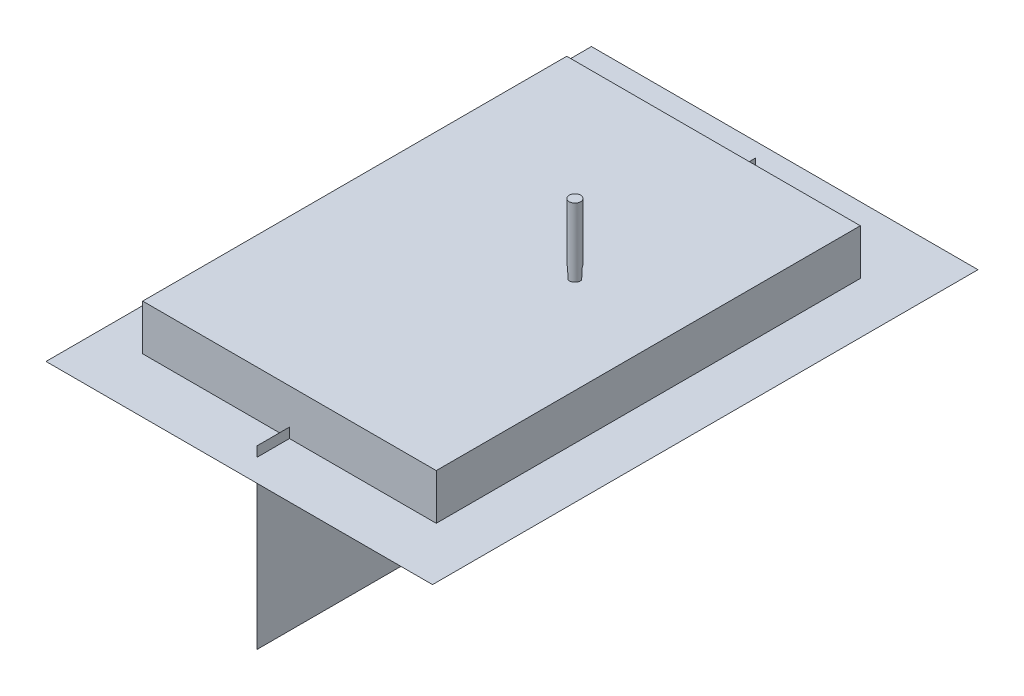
SolidWorks part; units mm, degrees
ref_plane "Front Plane" through (0, 0, 0) normal (0, 0, 1) x (1, 0, 0)
ref_plane "Top Plane" through (0, 0, 0) normal (0, 1, 0) x (1, 0, 0)
ref_plane "3Axis" through (0, 0, 0) normal (1, 0, 0) x (0, 0, -1)
sketch "Sketch1" plane through (0, 0, 0) normal (0, 1, 0) x (1, 0, 0)
  line L0 (0, 0) -> (0, 250) construction
  line L1 (50, 60) -> (0, 60) construction
  line L2 (85, 160) -> (0, 160) construction
  line L3 (0, 250) -> (-116.0481, 250) construction
  line L4 (0, 0) -> (-44.4749, 0) construction
  arc A0 (0, 250) -> (84.993, 169.8428) centre (0, 164.8611) cw
  arc A1 (79.2344, 154.5957) -> (50, 60) centre (155.2344, 79.293) ccw
  arc A2 (50, 60) -> (0, 0) centre (0, 50.8333) cw
  arc A3 (84.993, 169.8428) -> (79.2344, 154.5957) centre (65.0273, 168.6725) cw
  dimension "D2" = 50
  dimension "D7" = 20
  dimension "D1" = 250
  dimension "D3" = 60
  dimension "D4" = 100
  dimension "D5" = 85
sketch "Sketch2" plane through (0, 0, 0) normal (0, 1, 0) x (1, 0, 0)
  line L0 (0, 0) -> (0, -82.5065) construction
  arc A0 (84.993, 169.8428) -> (0, 250) centre (0, 164.8611) ccw construction
  arc A1 (79.2344, 154.5957) -> (84.993, 169.8428) centre (65.0273, 168.6725) ccw construction
  arc A2 (79.2344, 154.5957) -> (50, 60) centre (155.2344, 79.293) ccw construction
  arc A3 (0, 0) -> (50, 60) centre (0, 50.8333) ccw construction
  arc A4 (84.993, 169.8428) -> (-84.993, 169.8428) centre (0, 164.8611) ccw
  arc A5 (79.2344, 154.5957) -> (84.993, 169.8428) centre (65.0273, 168.6725) ccw
  arc A6 (79.2344, 154.5957) -> (50, 60) centre (155.2344, 79.293) ccw
  arc A7 (-50, 60) -> (50, 60) centre (0, 50.8333) ccw
  arc A8 (-79.2344, 154.5957) -> (-50, 60) centre (-155.2344, 79.293) cw
  arc A9 (-79.2344, 154.5957) -> (-84.993, 169.8428) centre (-65.0273, 168.6725) cw
extrude "Boss-Extrude1" add sketch "Sketch2" along normal blind 2
sketch "Sketch3" plane through (0, 2, 0) normal (0, 1, 0) x (1, 0, 0)
  arc A18 (77.8137, 156.0034) -> (82.9964, 169.7257) centre (65.0273, 168.6725) ccw
  arc A19 (82.9964, 169.7257) -> (-82.9964, 169.7257) centre (0, 164.8611) ccw
  arc A20 (-82.9964, 169.7257) -> (-77.8137, 156.0034) centre (-65.0273, 168.6725) ccw
  arc A21 (-48.0328, 59.6393) -> (-77.8137, 156.0034) centre (-155.2344, 79.293) ccw
  arc A22 (-48.0328, 59.6393) -> (48.0328, 59.6393) centre (0, 50.8333) ccw
  arc A23 (77.8137, 156.0034) -> (48.0328, 59.6393) centre (155.2344, 79.293) ccw
  arc A24 (77.8137, 156.0034) -> (82.9964, 169.7257) centre (65.0273, 168.6725) ccw
  arc A25 (82.9964, 169.7257) -> (-82.9964, 169.7257) centre (0, 164.8611) ccw
  arc A26 (-82.9964, 169.7257) -> (-77.8137, 156.0034) centre (-65.0273, 168.6725) ccw
  arc A27 (-48.0328, 59.6393) -> (-77.8137, 156.0034) centre (-155.2344, 79.293) ccw
  arc A28 (-48.0328, 59.6393) -> (48.0328, 59.6393) centre (0, 50.8333) ccw
  arc A29 (77.8137, 156.0034) -> (48.0328, 59.6393) centre (155.2344, 79.293) ccw
  dimension "D1" = 2
extrude "Boss-Extrude2" add sketch "Sketch3" along normal blind 2
sketch "Sketch4" plane through (0, 4, 0) normal (0, 1, 0) x (1, 0, 0)
  arc A12 (76.393, 157.4111) -> (46.0656, 59.2787) centre (155.2344, 79.293) ccw
  arc A13 (76.393, 157.4111) -> (80.9999, 169.6087) centre (65.0273, 168.6725) ccw
  arc A14 (80.9999, 169.6087) -> (-80.9999, 169.6087) centre (0, 164.8611) ccw
  arc A15 (-80.9999, 169.6087) -> (-76.393, 157.4111) centre (-65.0273, 168.6725) ccw
  arc A16 (-46.0656, 59.2787) -> (-76.393, 157.4111) centre (-155.2344, 79.293) ccw
  arc A17 (-46.0656, 59.2787) -> (46.0656, 59.2787) centre (0, 50.8333) ccw
  arc A18 (76.393, 157.4111) -> (46.0656, 59.2787) centre (155.2344, 79.293) ccw
  arc A19 (76.393, 157.4111) -> (80.9999, 169.6087) centre (65.0273, 168.6725) ccw
  arc A20 (80.9999, 169.6087) -> (-80.9999, 169.6087) centre (0, 164.8611) ccw
  arc A21 (-80.9999, 169.6087) -> (-76.393, 157.4111) centre (-65.0273, 168.6725) ccw
  arc A22 (-46.0656, 59.2787) -> (-76.393, 157.4111) centre (-155.2344, 79.293) ccw
  arc A23 (-46.0656, 59.2787) -> (46.0656, 59.2787) centre (0, 50.8333) ccw
  dimension "D1" = 2
extrude "Boss-Extrude3" add sketch "Sketch4" along normal blind 2
sketch "Sketch5" plane through (0, 6, 0) normal (0, 1, 0) x (1, 0, 0)
  arc A12 (74.9723, 158.8187) -> (79.0033, 169.4917) centre (65.0273, 168.6725) ccw
  arc A13 (79.0033, 169.4917) -> (-79.0033, 169.4917) centre (0, 164.8611) ccw
  arc A14 (-79.0033, 169.4917) -> (-74.9723, 158.8187) centre (-65.0273, 168.6725) ccw
  arc A15 (-44.0984, 58.918) -> (-74.9723, 158.8187) centre (-155.2344, 79.293) ccw
  arc A16 (-44.0984, 58.918) -> (44.0984, 58.918) centre (0, 50.8333) ccw
  arc A17 (74.9723, 158.8187) -> (44.0984, 58.918) centre (155.2344, 79.293) ccw
  arc A18 (74.9723, 158.8187) -> (79.0033, 169.4917) centre (65.0273, 168.6725) ccw
  arc A19 (79.0033, 169.4917) -> (-79.0033, 169.4917) centre (0, 164.8611) ccw
  arc A20 (-79.0033, 169.4917) -> (-74.9723, 158.8187) centre (-65.0273, 168.6725) ccw
  arc A21 (-44.0984, 58.918) -> (-74.9723, 158.8187) centre (-155.2344, 79.293) ccw
  arc A22 (-44.0984, 58.918) -> (44.0984, 58.918) centre (0, 50.8333) ccw
  arc A23 (74.9723, 158.8187) -> (44.0984, 58.918) centre (155.2344, 79.293) ccw
  dimension "D1" = 2
extrude "Boss-Extrude4" add sketch "Sketch5" along normal blind 2
sketch "Sketch6" plane through (0, 8, 0) normal (0, 1, 0) x (1, 0, 0)
  line L0 (0, 0) -> (0, 303.3461) construction
  arc A12 (73.5516, 160.2264) -> (42.1311, 58.5574) centre (155.2344, 79.293) ccw
  arc A13 (73.5516, 160.2264) -> (77.0067, 169.3747) centre (65.0273, 168.6725) ccw
  arc A14 (77.0067, 169.3747) -> (-77.0067, 169.3747) centre (0, 164.8611) ccw
  arc A15 (-77.0067, 169.3747) -> (-73.5516, 160.2264) centre (-65.0273, 168.6725) ccw
  arc A16 (-42.1311, 58.5574) -> (-73.5516, 160.2264) centre (-155.2344, 79.293) ccw
  arc A17 (-42.1311, 58.5574) -> (42.1311, 58.5574) centre (0, 50.8333) ccw
  arc A18 (73.5516, 160.2264) -> (42.1311, 58.5574) centre (155.2344, 79.293) ccw
  arc A19 (73.5516, 160.2264) -> (77.0067, 169.3747) centre (65.0273, 168.6725) ccw
  arc A20 (77.0067, 169.3747) -> (-77.0067, 169.3747) centre (0, 164.8611) ccw
  arc A21 (-77.0067, 169.3747) -> (-73.5516, 160.2264) centre (-65.0273, 168.6725) ccw
  arc A22 (-42.1311, 58.5574) -> (-73.5516, 160.2264) centre (-155.2344, 79.293) ccw
  arc A23 (-42.1311, 58.5574) -> (42.1311, 58.5574) centre (0, 50.8333) ccw
  ellipse E0 centre (0, 90) end of major axis (0, 115) minor radius 7.5
  dimension "D1" = 50
  dimension "D2" = 65
  dimension "D3" = 15
  dimension "D4" = 2
extrude "Boss-Extrude5" add sketch "Sketch6" along normal blind 2
sketch "Sketch7" plane through (0, 10, 0) normal (0, 1, 0) x (1, 0, 0)
  arc A12 (72.1309, 161.6341) -> (75.0102, 169.2576) centre (65.0273, 168.6725) ccw
  arc A13 (75.0102, 169.2576) -> (-75.0102, 169.2576) centre (0, 164.8611) ccw
  arc A14 (-75.0102, 169.2576) -> (-72.1309, 161.6341) centre (-65.0273, 168.6725) ccw
  arc A15 (-40.1639, 58.1967) -> (-72.1309, 161.6341) centre (-155.2344, 79.293) ccw
  arc A16 (-40.1639, 58.1967) -> (40.1639, 58.1967) centre (0, 50.8333) ccw
  arc A17 (72.1309, 161.6341) -> (40.1639, 58.1967) centre (155.2344, 79.293) ccw
  arc A18 (72.1309, 161.6341) -> (75.0102, 169.2576) centre (65.0273, 168.6725) ccw
  arc A19 (75.0102, 169.2576) -> (-75.0102, 169.2576) centre (0, 164.8611) ccw
  arc A20 (-75.0102, 169.2576) -> (-72.1309, 161.6341) centre (-65.0273, 168.6725) ccw
  arc A21 (-40.1639, 58.1967) -> (-72.1309, 161.6341) centre (-155.2344, 79.293) ccw
  arc A22 (-40.1639, 58.1967) -> (40.1639, 58.1967) centre (0, 50.8333) ccw
  arc A23 (72.1309, 161.6341) -> (40.1639, 58.1967) centre (155.2344, 79.293) ccw
  spline S0 degree 3 number of poles 105 (0, 63) -> (0, 63)
  spline S1 degree 3 number of poles 105 (0, 63) -> (0, 63)
  dimension "D1" = 2
  dimension "D2" = 2
extrude "Boss-Extrude6" add sketch "Sketch7" along normal blind 2
sketch "Sketch8" plane through (0, 12, 0) normal (0, 1, 0) x (1, 0, 0)
  arc A12 (70.7101, 163.0418) -> (38.1967, 57.8361) centre (155.2344, 79.293) ccw
  arc A13 (70.7101, 163.0418) -> (73.0136, 169.1406) centre (65.0273, 168.6725) ccw
  arc A14 (73.0136, 169.1406) -> (-73.0136, 169.1406) centre (0, 164.8611) ccw
  arc A15 (-73.0136, 169.1406) -> (-70.7101, 163.0418) centre (-65.0273, 168.6725) ccw
  arc A16 (-38.1967, 57.8361) -> (-70.7101, 163.0418) centre (-155.2344, 79.293) ccw
  arc A17 (-38.1967, 57.8361) -> (38.1967, 57.8361) centre (0, 50.8333) ccw
  arc A18 (70.7101, 163.0418) -> (38.1967, 57.8361) centre (155.2344, 79.293) ccw
  arc A19 (70.7101, 163.0418) -> (73.0136, 169.1406) centre (65.0273, 168.6725) ccw
  arc A20 (73.0136, 169.1406) -> (-73.0136, 169.1406) centre (0, 164.8611) ccw
  arc A21 (-73.0136, 169.1406) -> (-70.7101, 163.0418) centre (-65.0273, 168.6725) ccw
  arc A22 (-38.1967, 57.8361) -> (-70.7101, 163.0418) centre (-155.2344, 79.293) ccw
  arc A23 (-38.1967, 57.8361) -> (38.1967, 57.8361) centre (0, 50.8333) ccw
  spline S2 degree 3 number of poles 111 (-0.0534, 118.9998) -> (-0.0534, 118.9998)
  spline S3 degree 3 number of poles 111 (-0.0534, 118.9998) -> (-0.0534, 118.9998)
  dimension "D1" = 2
  dimension "D2" = 2
extrude "Boss-Extrude7" add sketch "Sketch8" along normal blind 2
sketch "Sketch9" plane through (0, 14, 0) normal (0, 1, 0) x (1, 0, 0)
  arc A12 (69.2894, 164.4495) -> (71.017, 169.0236) centre (65.0273, 168.6725) ccw
  arc A13 (71.017, 169.0236) -> (-71.017, 169.0236) centre (0, 164.8611) ccw
  arc A14 (-71.017, 169.0236) -> (-69.2894, 164.4495) centre (-65.0273, 168.6725) ccw
  arc A15 (-36.2295, 57.4754) -> (-69.2894, 164.4495) centre (-155.2344, 79.293) ccw
  arc A16 (-36.2295, 57.4754) -> (36.2295, 57.4754) centre (0, 50.8333) ccw
  arc A17 (69.2894, 164.4495) -> (36.2295, 57.4754) centre (155.2344, 79.293) ccw
  arc A18 (69.2894, 164.4495) -> (71.017, 169.0236) centre (65.0273, 168.6725) ccw
  arc A19 (71.017, 169.0236) -> (-71.017, 169.0236) centre (0, 164.8611) ccw
  arc A20 (-71.017, 169.0236) -> (-69.2894, 164.4495) centre (-65.0273, 168.6725) ccw
  arc A21 (-36.2295, 57.4754) -> (-69.2894, 164.4495) centre (-155.2344, 79.293) ccw
  arc A22 (-36.2295, 57.4754) -> (36.2295, 57.4754) centre (0, 50.8333) ccw
  arc A23 (69.2894, 164.4495) -> (36.2295, 57.4754) centre (155.2344, 79.293) ccw
  spline S3 degree 3 number of poles 119 (-0.0126, 59) -> (-0.0126, 59)
  spline S4 degree 3 number of poles 119 (-0.0126, 59) -> (-0.0126, 59)
  dimension "D1" = 2
  dimension "D2" = 2
extrude "Boss-Extrude8" add sketch "Sketch9" along normal blind 2
sketch "Sketch10" plane through (0, 16, 0) normal (0, 1, 0) x (1, 0, 0)
  arc A12 (66.448, 167.2648) -> (32.2951, 56.7541) centre (155.2344, 79.293) ccw
  arc A13 (66.448, 167.2648) -> (67.0239, 168.7895) centre (65.0273, 168.6725) ccw
  arc A14 (67.0239, 168.7895) -> (-67.0239, 168.7895) centre (0, 164.8611) ccw
  arc A15 (-67.0239, 168.7895) -> (-66.448, 167.2648) centre (-65.0273, 168.6725) ccw
  arc A16 (-32.2951, 56.7541) -> (-66.448, 167.2648) centre (-155.2344, 79.293) ccw
  arc A17 (-32.2951, 56.7541) -> (32.2951, 56.7541) centre (0, 50.8333) ccw
  arc A18 (66.448, 167.2648) -> (32.2951, 56.7541) centre (155.2344, 79.293) ccw
  arc A19 (66.448, 167.2648) -> (67.0239, 168.7895) centre (65.0273, 168.6725) ccw
  arc A20 (67.0239, 168.7895) -> (-67.0239, 168.7895) centre (0, 164.8611) ccw
  arc A21 (-67.0239, 168.7895) -> (-66.448, 167.2648) centre (-65.0273, 168.6725) ccw
  arc A22 (-32.2951, 56.7541) -> (-66.448, 167.2648) centre (-155.2344, 79.293) ccw
  arc A23 (-32.2951, 56.7541) -> (32.2951, 56.7541) centre (0, 50.8333) ccw
  spline S4 degree 3 number of poles 115 (-0.0223, 123) -> (-0.0223, 123)
  spline S5 degree 3 number of poles 115 (-0.0223, 123) -> (-0.0223, 123)
  dimension "D1" = 4
  dimension "D2" = 2
extrude "Boss-Extrude9" add sketch "Sketch10" along normal blind 2
sketch "Sketch11" plane through (0, 18, 0) normal (0, 1, 0) x (1, 0, 0)
  line L0 (-50, 185) -> (50, 185) construction
  line L1 (0, 0) -> (0, 185) construction
  line L2 (0, 175) -> (-18.0541, 175) construction
  arc A0 (-50, 185) -> (50, 185) centre (0, 158.3333) cw
  arc A1 (50, 185) -> (30, 166.3644) centre (37.5198, 178.3439) cw
  arc A2 (30, 166.3644) -> (-30, 166.3644) centre (0, 118.5726) ccw
  arc A3 (-50, 185) -> (-30, 166.3644) centre (-37.5198, 178.3439) ccw
  circle A4 centre (0, 42) radius 12.5 construction
  ellipse E0 centre (0, 42) end of major axis (-22.5, 42) minor radius 12.5
  point P6 (0, 215)
  dimension "D1" = 100
  dimension "D3" = 30
  dimension "D4" = 10
  dimension "D5" = 30
  dimension "D6" = 25
  dimension "D7" = 42
  dimension "D2" = 185
  dimension "D8" = 45
extrude "Boss-Extrude10" add sketch "Sketch11" along normal blind 2
sketch "Sketch12" plane through (0, 20, 0) normal (0, 1, 0) x (1, 0, 0)
  arc A8 (-46.4706, 183.1176) -> (-32.1266, 169.7522) centre (-37.5198, 178.3439) ccw
  arc A9 (32.1266, 169.7522) -> (-32.1266, 169.7522) centre (0, 118.5726) ccw
  arc A10 (32.1266, 169.7522) -> (46.4706, 183.1176) centre (37.5198, 178.3439) ccw
  arc A11 (46.4706, 183.1176) -> (-46.4706, 183.1176) centre (0, 158.3333) ccw
  arc A12 (-46.4706, 183.1176) -> (-32.1266, 169.7522) centre (-37.5198, 178.3439) ccw
  arc A13 (32.1266, 169.7522) -> (-32.1266, 169.7522) centre (0, 118.5726) ccw
  arc A14 (32.1266, 169.7522) -> (46.4706, 183.1176) centre (37.5198, 178.3439) ccw
  arc A15 (46.4706, 183.1176) -> (-46.4706, 183.1176) centre (0, 158.3333) ccw
  dimension "D1" = 4
extrude "Boss-Extrude11" add sketch "Sketch12" along normal blind 2
sketch "Sketch13" plane through (0, 22, 0) normal (0, 1, 0) x (1, 0, 0)
  arc A8 (42.9412, 181.2353) -> (-42.9412, 181.2353) centre (0, 158.3333) ccw
  arc A9 (-42.9412, 181.2353) -> (-34.2533, 173.14) centre (-37.5198, 178.3439) ccw
  arc A10 (34.2533, 173.14) -> (-34.2533, 173.14) centre (0, 118.5726) ccw
  arc A11 (34.2533, 173.14) -> (42.9412, 181.2353) centre (37.5198, 178.3439) ccw
  arc A12 (42.9412, 181.2353) -> (-42.9412, 181.2353) centre (0, 158.3333) ccw
  arc A13 (-42.9412, 181.2353) -> (-34.2533, 173.14) centre (-37.5198, 178.3439) ccw
  arc A14 (34.2533, 173.14) -> (-34.2533, 173.14) centre (0, 118.5726) ccw
  arc A15 (34.2533, 173.14) -> (42.9412, 181.2353) centre (37.5198, 178.3439) ccw
  dimension "D1" = 4
extrude "Boss-Extrude12" add sketch "Sketch13" along normal blind 1
sketch "Sketch14" plane through (0, 18, 0) normal (0, 1, 0) x (1, 0, 0)
  circle A0 centre (30, 140) radius 3.5
  dimension "D1" = 140
  dimension "D3" = 7
  dimension "D2" = 30
extrude "Boss-Extrude13" add sketch "Sketch14" along normal blind 50 from offset 2 separate body
sketch "Sketch15" plane through (0, 20, 0) normal (0, -1, 0) x (1, 0, 0)
  line L0 (30, -140) -> (26.5, -140)
  line L1 (30, -140) -> (30, -136.5)
  line L2 (30, -136.5) -> (30, -132.6555)
  line L3 (35.1783, -139.0632) -> (35.1988, -139.0529)
  line L4 (30, -132.6555) -> (23.2259, -140)
  line L5 (23.2259, -140) -> (26.5, -140)
  line L6 (30, -140) -> (37.6715, -140)
  line L7 (37.6715, -140) -> (30, -148.3175)
  line L8 (30, -148.3175) -> (30, -140)
  circle A0 centre (30, -140) radius 3.5 construction
extrude "Cut-Extrude1" cut sketch "Sketch15" against normal blind 15 draft 5 contours L8 L6 M1 | L8 L7 L6 M1 | L0 L1 M1 | L4 L5 L2 M1
sketch "Sketch17" plane through (0, 0, 0) normal (0, 1, 0) x (1, 0, 0)
  line L1 (-90, 255) -> (90, 255)
  line L2 (-90, 255) -> (-90, -5)
  line L3 (-90, -5) -> (90, -5)
  line L4 (90, 255) -> (90, -5)
  point P7 (0, -5)
  dimension "D1" = 5
  dimension "D2" = 180
  dimension "D3" = 260
extrude "Boss-Extrude14" add sketch "Sketch17" along normal blind 28 separate body
combine bodies "Combine1" operation type subtract main body 115 bodies to subtract 112
ref_plane "2Axis" through (0, 0, 0) normal (0, -1, 0) x (-1, 0, 0)
sketch "Sketch19" plane through (0, 0, 0) normal (0, -1, 0) x (-1, 0, 0)
  line L1 (-121.4132, 295.7457) -> (115.582, 295.7457)
  line L2 (-121.4132, 295.7457) -> (-121.4132, -38.6943)
  line L3 (-121.4132, -38.6943) -> (115.582, -38.6943)
  line L4 (115.582, 295.7457) -> (115.582, -38.6943)
surface "Surface-Plane1" sketch "Sketch19"
sketch "Sketch20" plane through (0, 0, 0) normal (1, 0, 0) x (0, 0, -1)
  line L1 (-24.8943, 6.0959) -> (280.8803, 6.0959)
  line L2 (-24.8943, 6.0959) -> (-24.8943, -102.0439)
  line L3 (-24.8943, -102.0439) -> (280.8803, -102.0439)
  line L4 (280.8803, 6.0959) -> (280.8803, -102.0439)
surface "Surface-Plane2" sketch "Sketch20"
